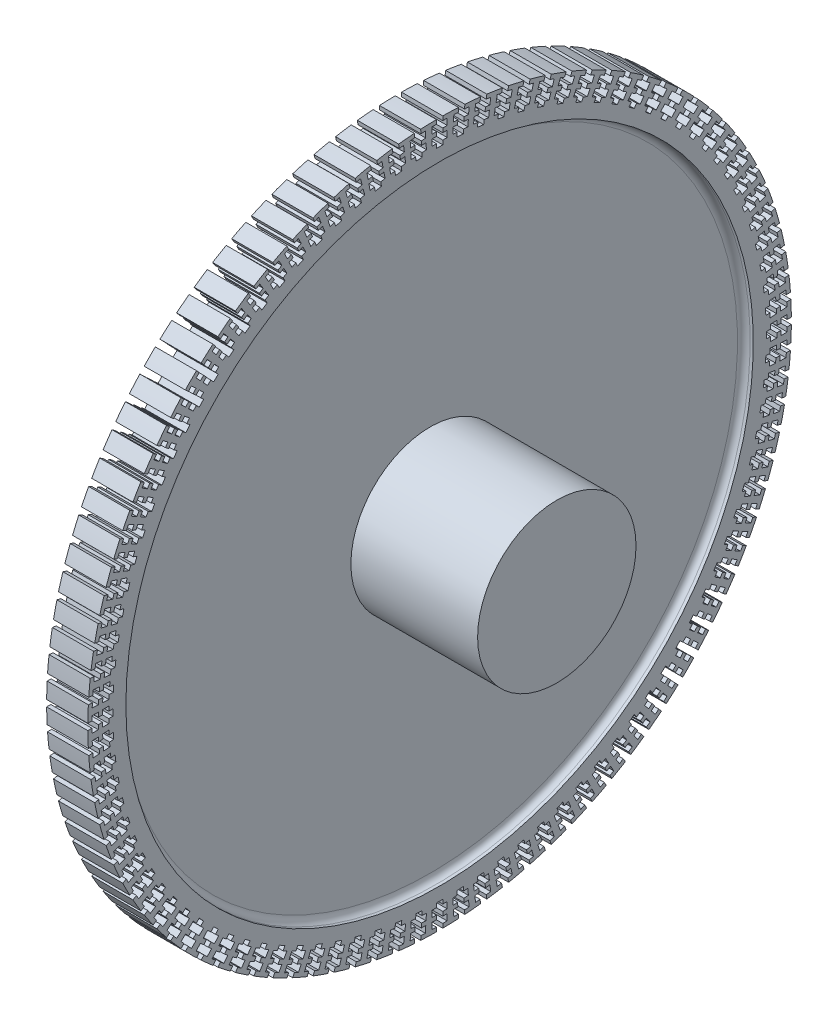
SolidWorks part; units mm, degrees
ref_plane "Front Plane" through (0, 0, 0) normal (0, 0, 1) x (1, 0, 0)
ref_plane "Top Plane" through (0, 0, 0) normal (0, 1, 0) x (1, 0, 0)
ref_plane "Right Plane" through (0, 0, 0) normal (1, 0, 0) x (0, 0, -1)
sketch "Sketch1" plane through (0, 0, 0) normal (0, 0, 1) x (1, 0, 0)
  line L0 (-75.92, -25.125) -> (74.08, -25.125) construction
  line L1 (-70.92, 470) -> (-70.92, 530)
  line L2 (-70.92, 530) -> (-5.92, 530)
  line L3 (-70.92, 470) -> (-65.92, 470)
  line L4 (-5.92, 470) -> (-5.92, 530)
  line L5 (-5.92, 470) -> (-10.92, 470)
  line L6 (-20.92, 460) -> (-20.92, 5)
  line L7 (-55.92, 460) -> (-55.92, -25.125)
  line L8 (-55.92, -25.125) -> (-20.92, -25.125)
  line L10 (-38.42, 530) -> (-38.42, -30) construction
  line L14 (-20.92, -25.125) -> (-20.92, 5)
  arc A1 (-10.92, 470) -> (-20.92, 460) centre (-10.92, 460) ccw
  arc A2 (-65.92, 470) -> (-55.92, 460) centre (-65.92, 460) cw
  point P14 (-20.92, 470)
  point P15 (-35, 215)
  point P19 (-55.92, 470)
  point P27 (-38.42, 3.5364)
  dimension "D1" = 15
  dimension "D3" = 65
  dimension "D4" = 60
  dimension "D2" = 555.125
  dimension "D7" = 10
revolve "Revolve1" add sketch "Sketch1" angle 360 about L0
sketch "Sketch2" plane through (-5.92, 0, 0) normal (1, 0, 0) x (0, 0, -1)
  line L0 (0, 530) -> (0, 375.1952) construction
  line L1 (-5, 523.4775) -> (-5, 529.9775)
  line L2 (5, 523.4775) -> (5, 529.9775)
  line L4 (5, 523.4775) -> (12, 523.4775)
  line L5 (12, 523.4775) -> (12, 513.4775)
  line L6 (12, 513.4775) -> (5, 513.4775)
  line L7 (5, 513.4775) -> (5, 506.9775)
  line L8 (5, 506.9775) -> (12, 506.9775)
  line L9 (12, 506.9775) -> (12, 496.9775)
  line L10 (12, 496.9775) -> (5, 496.9775)
  line L11 (5, 496.9775) -> (5, 490.4775)
  line L12 (5, 490.4775) -> (-5, 490.4775)
  line L13 (-5, 496.9775) -> (-5, 490.4775)
  line L14 (-12, 496.9775) -> (-5, 496.9775)
  line L15 (-12, 506.9775) -> (-12, 496.9775)
  line L16 (-5, 506.9775) -> (-12, 506.9775)
  line L17 (-5, 513.4775) -> (-5, 506.9775)
  line L18 (-12, 513.4775) -> (-5, 513.4775)
  line L19 (-12, 523.4775) -> (-12, 513.4775)
  line L20 (-5, 523.4775) -> (-12, 523.4775)
  circle A0 centre (0, -25.125) radius 555.125 construction
  circle A1 centre (0, -25.125) radius 555.125
  point P19 (0, 490.4775)
  dimension "D1" = 6.5
  dimension "D2" = 7
  dimension "D3" = 10
  dimension "D4" = 6.5
  dimension "D5" = 10
  dimension "D6" = 7
  dimension "D7" = 6.5
  dimension "D9" = 12
  dimension "D10" = 10
  dimension "D11" = 10
extrude "Cut-Extrude1" cut sketch "Sketch2" against normal through all and the other way through all contours L1 L20 L19 L18 L17 L16 L15 L14 L13 L12 L11 L10 L9 L8 L7 L6 L5 L4 L2
pattern_circular "CirPattern2" count 100 over 360 about axis through (-5.92, -25.125, 0) along (-1, 0, 0) of "Cut-Extrude1"
sketch "Sketch3" plane through (-55.92, 0, 0) normal (-1, 0, 0) x (0, 0, 1)
  circle A0 centre (0, -25.125) radius 140
  dimension "D1" = 280
extrude "Boss-Extrude1" add sketch "Sketch3" along normal blind 150 contours A0
sketch "Sketch5" plane through (-20.92, 0, 0) normal (1, 0, 0) x (0, 0, -1)
  circle A0 centre (0, -25.125) radius 125
  dimension "D1" = 250
extrude "Boss-Extrude2" add sketch "Sketch5" along normal blind 200 contours A0
